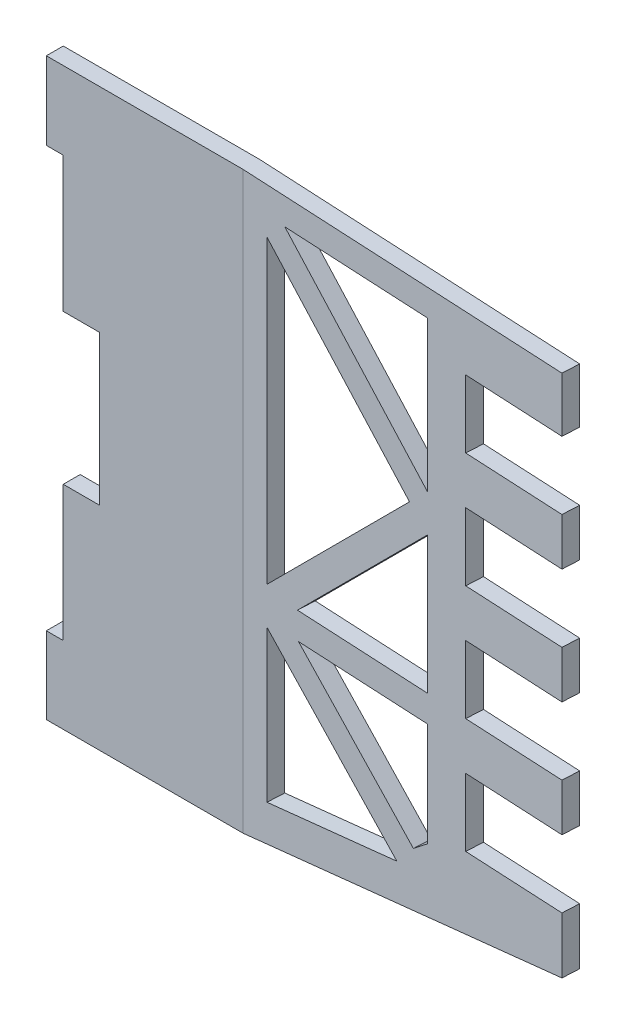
SolidWorks part; units mm, degrees
ref_plane "Front Plane" through (0, 0, 0) normal (0, 0, 1) x (1, 0, 0)
ref_plane "Top Plane" through (0, 0, 0) normal (0, 1, 0) x (1, 0, 0)
ref_plane "Right Plane" through (0, 0, 0) normal (1, 0, 0) x (0, 0, -1)
sketch "Sketch1" plane through (0, 0, 0) normal (0, 1, 0) x (1, 0, 0)
  line L0 (36.83, 0) -> (600, 0) construction
  line L1 (0, 0) -> (36.83, 0)
  line L2 (0, 0) -> (0, 5)
  line L3 (0, 5) -> (36.83, 5)
  line L4 (36.83, 0) -> (36.83, 5)
  line L5 (600, 0) -> (600, -28.58) construction
  line L6 (36.83, 0) -> (600, -28.58)
  line L7 (600, -28.58) -> (600, -23.58)
  line L8 (600, -23.58) -> (36.83, 5)
  line L9 (36.83, 2.5) -> (0, 2.5) construction
  point P5 (36.83, 2.5)
  dimension "D1" = 36.83
  dimension "D2" = 5
  dimension "D3" = 600
  dimension "D4" = 28.58
  dimension "D5" = 5
extrude "Boss-Extrude1" add sketch "Sketch1" along normal blind 106.172 contours L1 L4 L3 L2 | L7 L8 L4 L6
sketch "Sketch2" plane through (0.0946, 0, -1.8643) normal (-0.0507, 0, 0.9987) x (0.9987, 0, 0.0507)
  line L0 (590.6774, 84.16) -> (36.7827, 0)
  line L1 (590.6774, 84.16) -> (600.6774, 84.16)
  line L2 (600.6774, 106.172) -> (600.6774, 0) construction
  line L3 (36.7827, 0) -> (600.6774, 0) construction
  line L4 (600.6774, 84.16) -> (620.3149, 84.16)
  line L5 (620.3149, 84.16) -> (620.3149, 0)
  line L6 (620.3149, 0) -> (36.7827, 0)
  dimension "D1" = 8.64
  dimension "D2" = 10
  dimension "D3" = 84.16
extrude "Cut-Extrude1" cut sketch "Sketch2" against normal through all both and the other way through all contours L1 L0 M1 M2
sketch "Sketch3" plane through (0, 0, -5) normal (0, 0, -1) x (-1, 0, 0)
  line L0 (0, 106.172) -> (0, 91.6)
  line L1 (0, 106.172) -> (0, 0) construction
  line L2 (0, 91.6) -> (-3.1749, 91.6)
  line L3 (-3.1749, 91.6) -> (-3.1749, 66.2)
  line L4 (-3.1749, 66.2) -> (-10, 66.2)
  line L5 (0, 52.15) -> (-10, 52.15) construction
  line L6 (-10, 66.2) -> (-10, 38.1)
  line L7 (0, 106.172) -> (-36.83, 106.172) construction
  line L8 (-3.1749, 38.1) -> (-10, 38.1)
  line L9 (0, -1.872) -> (0, 12.7)
  line L10 (0, 12.7) -> (-3.1749, 12.7)
  line L11 (-3.1749, 12.7) -> (-3.1749, 38.1)
  dimension "D1" = 3.1749
  dimension "D2" = 10
  dimension "D3" = 14.572
  dimension "D4" = 28.1
sketch "Sketch6" plane through (0.3477, 0, -6.8514) normal (0.0507, 0, -0.9987) x (-0.9987, 0, -0.0507)
  line L0 (-168.5292, 101.172) -> (-168.5292, 37.672) construction
  line L1 (-600.424, 106.172) -> (-600.424, 69.422) construction
  line L2 (-600.424, 69.422) -> (-36.5292, 69.422) construction
  line L3 (-36.5292, 106.172) -> (-36.5292, 0) construction
  line L4 (-105.0292, 37.672) -> (-168.5292, 101.172) construction
  line L5 (-105.0292, 101.172) -> (-136.7792, 69.422) construction
  line L6 (-658.924, 89.16) -> (-653.7997, 89.16)
  line L7 (-105.0292, 5.7786) -> (-105.0292, 101.172)
  line L8 (-105.0292, 101.172) -> (-658.924, 101.172)
  line L9 (-658.924, 101.172) -> (-658.924, 89.16)
  line L10 (-136.7792, 69.422) -> (-168.5292, 37.672) construction
  line L11 (-232.0292, 101.172) -> (-232.0292, 37.672) construction
  line L12 (-168.5292, 37.672) -> (-232.0292, 101.172) construction
  line L13 (-168.5292, 101.172) -> (-200.2792, 69.422) construction
  line L14 (-722.424, 89.16) -> (-717.2997, 89.16)
  line L15 (-168.5292, 5.7786) -> (-168.5292, 101.172)
  line L16 (-168.5292, 101.172) -> (-722.424, 101.172)
  line L17 (-722.424, 101.172) -> (-722.424, 89.16)
  line L18 (-200.2792, 69.422) -> (-232.0292, 37.672) construction
  line L19 (-295.5292, 101.172) -> (-295.5292, 37.672) construction
  line L20 (-232.0292, 37.672) -> (-295.5292, 101.172) construction
  line L21 (-232.0292, 101.172) -> (-263.7792, 69.422) construction
  line L22 (-785.924, 89.16) -> (-780.7997, 89.16)
  line L23 (-232.0292, 5.7786) -> (-232.0292, 101.172)
  line L24 (-41.5292, 101.172) -> (-77.697, 101.172) construction
  line L25 (-41.5292, 37.672) -> (-595.424, 37.672)
  line L26 (-41.5292, 101.172) -> (-73.2792, 69.422) construction
  line L27 (-73.2792, 69.422) -> (-105.0292, 37.672) construction
  line L28 (-41.5292, 37.672) -> (-105.0292, 101.172) construction
  line L29 (-105.0292, 101.172) -> (-105.0292, 37.672) construction
  line L30 (-595.424, 89.16) -> (-590.2997, 89.16)
  line L32 (-41.5292, 5.7786) -> (-41.5292, 101.172)
  line L33 (-41.5292, 101.172) -> (-595.424, 101.172)
  line L34 (-595.424, 101.172) -> (-595.424, 89.16)
  line L37 (-41.5292, 5.7786) -> (-41.5292, 101.172)
  line L38 (-41.5292, 101.172) -> (-595.424, 101.172)
  line L39 (-595.424, 101.172) -> (-595.424, 89.16)
  line L40 (-232.0292, 101.172) -> (-785.924, 101.172)
  line L41 (-785.924, 101.172) -> (-785.924, 89.16)
  line L42 (-263.7792, 69.422) -> (-295.5292, 37.672) construction
  line L43 (-359.0292, 101.172) -> (-359.0292, 37.672) construction
  line L44 (-295.5292, 37.672) -> (-359.0292, 101.172) construction
  line L45 (-295.5292, 101.172) -> (-327.2792, 69.422) construction
  line L46 (-849.424, 89.16) -> (-844.2997, 89.16)
  line L47 (-295.5292, 5.7786) -> (-295.5292, 101.172)
  line L48 (-295.5292, 101.172) -> (-849.424, 101.172)
  line L49 (-849.424, 101.172) -> (-849.424, 89.16)
  line L50 (-327.2792, 69.422) -> (-359.0292, 37.672) construction
  line L51 (-422.5292, 101.172) -> (-422.5292, 37.672) construction
  line L52 (-359.0292, 37.672) -> (-422.5292, 101.172) construction
  line L53 (-359.0292, 101.172) -> (-390.7792, 69.422) construction
  line L54 (-912.924, 89.16) -> (-907.7997, 89.16)
  line L55 (-359.0292, 5.7786) -> (-359.0292, 101.172)
  line L56 (-359.0292, 101.172) -> (-912.924, 101.172)
  line L57 (-912.924, 101.172) -> (-912.924, 89.16)
  line L58 (-390.7792, 69.422) -> (-422.5292, 37.672) construction
  line L59 (-486.0292, 101.172) -> (-486.0292, 37.672) construction
  line L60 (-422.5292, 37.672) -> (-486.0292, 101.172) construction
  line L61 (-422.5292, 101.172) -> (-454.2792, 69.422) construction
  line L62 (-976.424, 89.16) -> (-971.2997, 89.16)
  line L63 (-422.5292, 5.7786) -> (-422.5292, 101.172)
  line L64 (-422.5292, 101.172) -> (-976.424, 101.172)
  line L65 (-976.424, 101.172) -> (-976.424, 89.16)
  line L66 (-454.2792, 69.422) -> (-486.0292, 37.672) construction
  line L67 (-549.5292, 101.172) -> (-549.5292, 37.672) construction
  line L68 (-486.0292, 37.672) -> (-549.5292, 101.172) construction
  line L69 (-486.0292, 101.172) -> (-517.7792, 69.422) construction
  line L70 (-1039.924, 89.16) -> (-1034.7997, 89.16)
  line L71 (-486.0292, 5.7786) -> (-486.0292, 101.172)
  line L72 (-486.0292, 101.172) -> (-1039.924, 101.172)
  line L73 (-1039.924, 101.172) -> (-1039.924, 89.16)
  line L74 (-517.7792, 69.422) -> (-549.5292, 37.672) construction
  line L75 (-484.2615, 39.4398) -> (-552.0292, 107.2075)
  line L76 (-552.0292, 107.2075) -> (-552.0292, 37.672)
  line L77 (-487.797, 102.9398) -> (-519.547, 71.1898)
  line L78 (-420.7615, 39.4398) -> (-484.2615, 102.9398)
  line L79 (-424.297, 102.9398) -> (-456.047, 71.1898)
  line L80 (-456.047, 71.1898) -> (-487.797, 39.4398)
  line L81 (-357.2615, 39.4398) -> (-420.7615, 102.9398)
  line L82 (-360.797, 102.9398) -> (-392.547, 71.1898)
  line L83 (-392.547, 71.1898) -> (-424.297, 39.4398)
  line L84 (-293.7615, 39.4398) -> (-357.2615, 102.9398)
  line L85 (-233.797, 102.9398) -> (-265.547, 71.1898)
  line L86 (-265.547, 71.1898) -> (-297.297, 39.4398)
  line L87 (-166.7615, 39.4398) -> (-230.2615, 102.9398)
  line L88 (-106.797, 102.9398) -> (-138.547, 71.1898)
  line L89 (-138.547, 71.1898) -> (-170.297, 39.4398)
  line L90 (-39.7615, 39.4398) -> (-103.2615, 102.9398)
  line L91 (-43.297, 102.9398) -> (-75.047, 71.1898)
  line L92 (-75.047, 71.1898) -> (-106.797, 39.4398)
  line L93 (-103.2615, 39.4398) -> (-166.7615, 102.9398)
  line L94 (-170.297, 102.9398) -> (-202.047, 71.1898)
  line L95 (-202.047, 71.1898) -> (-233.797, 39.4398)
  line L96 (-230.2615, 39.4398) -> (-293.7615, 102.9398)
  line L97 (-297.297, 102.9398) -> (-329.047, 71.1898)
  line L98 (-329.047, 71.1898) -> (-360.797, 39.4398)
  line L99 (-487.797, 35.9042) -> (-547.0292, 95.1365)
  line L100 (-547.0292, 95.1365) -> (-547.0292, 37.672)
  line L101 (-484.2615, 99.4042) -> (-516.0115, 67.6542)
  line L102 (-424.297, 35.9042) -> (-487.797, 99.4042)
  line L103 (-420.7615, 99.4042) -> (-452.5115, 67.6542)
  line L104 (-452.5115, 67.6542) -> (-484.2615, 35.9042)
  line L105 (-360.797, 35.9042) -> (-424.297, 99.4042)
  line L106 (-357.2615, 99.4042) -> (-389.0115, 67.6542)
  line L107 (-389.0115, 67.6542) -> (-420.7615, 35.9042)
  line L108 (-297.297, 35.9042) -> (-360.797, 99.4042)
  line L109 (-230.2615, 99.4042) -> (-262.0115, 67.6542)
  line L110 (-262.0115, 67.6542) -> (-293.7615, 35.9042)
  line L111 (-170.297, 35.9042) -> (-233.797, 99.4042)
  line L112 (-103.2615, 99.4042) -> (-135.0115, 67.6542)
  line L113 (-135.0115, 67.6542) -> (-166.7615, 35.9042)
  line L114 (-43.297, 35.9042) -> (-106.797, 99.4042)
  line L115 (-39.7615, 99.4042) -> (-71.5115, 67.6542)
  line L116 (-71.5115, 67.6542) -> (-103.2615, 35.9042)
  line L117 (-106.797, 35.9042) -> (-170.297, 99.4042)
  line L118 (-166.7615, 99.4042) -> (-198.5115, 67.6542)
  line L119 (-198.5115, 67.6542) -> (-230.2615, 35.9042)
  line L120 (-233.797, 35.9042) -> (-297.297, 99.4042)
  line L121 (-293.7615, 99.4042) -> (-325.5115, 67.6542)
  line L122 (-325.5115, 67.6542) -> (-357.2615, 35.9042)
  line L123 (-359.0292, 101.172) -> (-359.0292, 41.1594) construction
  line L124 (-293.0292, 5.7786) -> (-293.0292, 101.172)
  line L125 (-229.5292, 5.7786) -> (-229.5292, 101.172)
  line L126 (-166.0292, 5.7786) -> (-166.0292, 101.172)
  line L127 (-102.5292, 5.7786) -> (-102.5292, 101.172)
  line L128 (-356.5292, 5.7786) -> (-356.5292, 101.172)
  line L129 (-420.0292, 5.7786) -> (-420.0292, 101.172)
  line L130 (-483.5292, 5.7786) -> (-483.5292, 101.172)
  line L131 (-298.0292, 5.7786) -> (-298.0292, 101.172)
  line L132 (-234.5292, 5.7786) -> (-234.5292, 101.172)
  line L133 (-171.0292, 5.7786) -> (-171.0292, 101.172)
  line L134 (-107.5292, 5.7786) -> (-107.5292, 101.172)
  line L135 (-361.5292, 5.7786) -> (-361.5292, 101.172)
  line L136 (-425.0292, 5.7786) -> (-425.0292, 101.172)
  line L137 (-488.5292, 5.7786) -> (-488.5292, 101.172)
  line L138 (-168.5292, 37.672) -> (-168.5292, 25.0784) construction
  line L139 (-105.0292, 37.672) -> (-105.0292, 15.4269) construction
  line L140 (-103.2615, 39.4398) -> (-131.2391, 19.4093) construction
  line L141 (-131.2391, 19.4093) -> (-168.5292, 37.672) construction
  line L142 (-105.0292, 37.672) -> (-70.3619, 10.1595) construction
  line L143 (-70.3619, 10.1595) -> (-41.5292, 37.672) construction
  line L144 (-104.7168, 41.4725) -> (-131.4804, 22.3112)
  line L145 (-131.4804, 22.3112) -> (-167.4297, 39.9172)
  line L146 (-106.5833, 35.7137) -> (-70.2109, 6.848)
  line L147 (-70.2109, 6.848) -> (-35.2879, 40.172)
  line L148 (-35.2879, 40.172) -> (-595.424, 40.172)
  line L149 (-101.8062, 37.407) -> (-130.9978, 16.5074)
  line L150 (-130.9978, 16.5074) -> (-169.6288, 35.4268)
  line L151 (-103.4751, 39.6303) -> (-70.5129, 13.4709)
  line L152 (-70.5129, 13.4709) -> (-47.7706, 35.172)
  line L153 (-47.7706, 35.172) -> (-595.424, 35.172)
  line L160 (-595.424, 89.16) -> (-590.2997, 89.16)
  line L161 (-590.2997, 89.16) -> (-41.5292, 5.7786)
  line L162 (-590.2997, 89.16) -> (-41.5292, 5.7786)
  dimension "D1" = 63.5
  dimension "D3" = 63.5
  dimension "D4" = 8
  dimension "D5" = 2.5
  dimension "D2" = 5
  dimension "D6" = 2.5
  dimension "D7" = 2.5
  dimension "D8" = 2.5
  dimension "D9" = 2.5
  dimension "D10" = 2.5
extrude "Cut-Extrude5" cut sketch "Sketch6" against normal through all contours L148 L114 L116 | L37 L115 L90 | L152 L153 L151 | L146 L127 L162 | L147 L162 L37 | L134 L149 L162 | L144 L153 L145 | L162 L150 L126 | L133 L153 L162 | L148 L111 L119 | L87 L133 L118 | L126 L89 L117 | L93 L88 L38 | L93 L134 L112 | L148 L117 L113 | L127 L92 L114 | L91 L38 L90 | L94 L38 L87 | L125 L95 L111 | L96 L132 L109 | L96 L85 L40 | L124 L162 L86 L120 | L162 L131 L121 L84 | L97 L48 L84 | L128 L162 L98 L108 | L108 L122 L162 | L162 L135 L106 L81 | L82 L56 L81 | L129 L162 L83 L105 | L162 L136 L103 | L79 L64 L78 | L77 L72 L75 L162 | L99 L100 L162 | L162 L137 L101 | L130 L162 L102 | L148 L120 L110 L162
sketch "Sketch7" plane through (0.0946, 0, -1.8643) normal (-0.0507, 0, 0.9987) x (0.9987, 0, 0.0507)
  line L0 (600.6774, 106.172) -> (600.6774, 100.172)
  line L2 (600.6774, 106.172) -> (600.6774, 84.16) construction
  line L3 (600.6774, 100.172) -> (590.6774, 100.172)
  line L4 (590.6774, 100.172) -> (590.6774, 106.172)
  line L5 (36.7827, 106.172) -> (600.6774, 106.172) construction
  line L6 (590.6774, 106.172) -> (600.6774, 106.172)
  line L7 (600.6774, 95.166) -> (564.3609, 95.166) construction
  line L8 (590.6774, 90.16) -> (590.6774, 84.16)
  line L9 (600.6774, 90.16) -> (590.6774, 90.16)
  line L10 (600.6774, 84.16) -> (600.6774, 90.16)
  line L11 (590.6774, 84.16) -> (600.6774, 84.16)
  dimension "D1" = 10
  dimension "D2" = 6
extrude "Cut-Extrude6" cut sketch "Sketch7" against normal through all both and the other way through all
ref_plane "Plane1" through (98.9611, 40.172, 3.1531) normal (0.9987, 0, 0.0507) x (0.0507, 0, -0.9987)
sketch "Sketch11" plane through (0.3477, 0, -6.8514) normal (0.0507, 0, -0.9987) x (-0.9987, 0, -0.0507)
  line L0 (-73.2792, 72.9575) -> (-73.2792, 106.172)
  line L1 (-590.6774, 106.172) -> (-36.5292, 106.172) construction
  line L2 (-73.2792, 106.172) -> (-73.2792, 5.5454)
  line L3 (-590.6774, 84.16) -> (-36.7827, 0) construction
  line L4 (-102.5292, 43.7075) -> (-102.5292, 95.1365) construction
  line L5 (-102.5292, 43.7075) -> (-102.5292, 95.1365)
  line L6 (-102.5292, 95.1365) -> (-102.5292, 106.172)
  line L7 (-102.5292, 106.172) -> (-73.2792, 106.172)
  line L8 (-73.2792, 5.5454) -> (-102.5292, 9.9897)
  line L9 (-102.5292, 9.9897) -> (-102.5292, 43.7075)
extrude "Boss-Extrude2" add sketch "Sketch11" against normal up to surface (4.9936 mm away) contours L9 L8 L2 L0 L7 L6 L5
sketch "Sketch12" plane through (0.3477, 0, -6.8514) normal (0.0507, 0, -0.9987) x (-0.9987, 0, -0.0507)
  line L0 (-107.5292, 95.1365) -> (-73.2792, 95.1365) construction
  line L1 (-73.2792, 101.172) -> (-73.2792, 72.9575) construction
  line L2 (-90.4042, 95.1365) -> (-90.4042, 106.172) construction
  line L3 (-590.6774, 106.172) -> (-36.5292, 106.172) construction
  line L4 (-90.4042, 106.172) -> (-90.4042, 8.1474) construction
  line L5 (-590.6774, 84.16) -> (-36.7827, 0) construction
  line L6 (-351.4969, 47.8184) -> (-345.3367, 73.3687) construction
  line L7 (-99.9292, 74.3047) -> (-80.8792, 74.3047)
  line L8 (-90.4042, 57.1597) -> (-107.5292, 57.1597) construction
  line L10 (-107.5292, 43.7075) -> (-107.5292, 95.1365) construction
  line L11 (-99.9292, 61.6047) -> (-80.8792, 61.6047)
  line L12 (-80.8792, 61.6047) -> (-80.8792, 74.3047)
  line L14 (-99.9292, 74.3047) -> (-99.9292, 61.6047)
  line L15 (-99.9292, 83.1947) -> (-99.9292, 95.8947)
  line L17 (-80.8792, 95.8947) -> (-80.8792, 83.1947)
  line L18 (-80.8792, 83.1947) -> (-99.9292, 83.1947)
  line L20 (-99.9292, 95.8947) -> (-80.8792, 95.8947)
  line L21 (-80.8792, 66.1582) -> (-99.9292, 67.9547)
  line L22 (-80.8792, 89.3844) -> (-99.9292, 89.5447)
  line L23 (-99.9292, 40.0147) -> (-99.9292, 52.7147)
  line L24 (-99.9292, 52.7147) -> (-80.8792, 52.7147)
  line L25 (-80.8792, 52.7147) -> (-80.8792, 40.0147)
  line L26 (-99.9292, 40.0147) -> (-80.8792, 40.0147)
  line L27 (-99.9292, 31.1247) -> (-99.9292, 18.4247)
  line L28 (-80.8792, 31.1247) -> (-99.9292, 31.1247)
  line L29 (-80.8792, 18.4247) -> (-80.8792, 31.1247)
  line L30 (-99.9292, 18.4247) -> (-80.8792, 18.4247)
  line L31 (-99.9292, 106.172) -> (-99.9292, 9.5946)
  line L32 (-99.9292, 9.5946) -> (-80.8792, 6.7001)
  line L33 (-80.8792, 6.7001) -> (-80.8792, 106.172)
  line L34 (-80.8792, 106.172) -> (-99.9292, 106.172)
  line L43 (-600.424, 90.16) -> (-590.6774, 90.16)
  line L44 (-590.6774, 84.16) -> (-36.7827, 0)
  line L45 (-36.7827, 0) -> (-36.5292, 0)
  line L46 (-36.5292, 0) -> (-36.5292, 106.172)
  line L47 (-36.5292, 106.172) -> (-590.6774, 106.172)
  line L48 (-590.6774, 106.172) -> (-590.6774, 100.172)
  line L49 (-590.6774, 100.172) -> (-600.424, 100.172)
  line L50 (-600.424, 100.172) -> (-600.424, 90.16)
  line L53 (-590.6774, 84.16) -> (-36.7827, 0)
  line L54 (-36.7827, 0) -> (-36.5292, 0)
  line L55 (-36.5292, 0) -> (-36.5292, 106.172)
  line L56 (-36.5292, 106.172) -> (-590.6774, 106.172)
  line L57 (-590.6774, 106.172) -> (-590.6774, 100.172)
  line L58 (-590.6774, 100.172) -> (-600.424, 100.172)
  line L59 (-600.424, 100.172) -> (-600.424, 90.16)
  line L62 (-600.424, 90.16) -> (-590.6774, 90.16)
  line L63 (-590.6774, 90.16) -> (-590.6774, 84.16)
  line L64 (-590.6774, 90.16) -> (-590.6774, 84.16)
  point P25 (-90.4042, 67.0565)
  point P30 (-345.3367, 73.3687)
  point P33 (-90.4042, 89.4646)
  dimension "D1" = 12.7
  dimension "D2" = 4.445
  dimension "D3" = 19.05
  dimension "D4" = 19.05
  dimension "D5" = 8.89
  dimension "D6" = 12.7
  dimension "D7" = 48.0763
  dimension "D8" = 10.2773
  dimension "D9" = 7.6
  dimension "D10" = 19.05
  dimension "D11" = 19.05
  dimension "D12" = 0
extrude "Cut-Extrude7" cut sketch "Sketch12" against normal through all both and the other way through all contours L62 L64 L53 L31 L27 L23 L14 L15 L56 L57 L58 L59 | L22 L17 L20 L15 | L17 L22 L15 L18 | L21 L12 L7 L14 | L12 L21 L14 L11 | L23 L26 L25 L24 | L27 L30 L29 L28
ref_plane "Plane2" through (600, 90.16, 23.58) normal (0, -1, 0) x (-1, 0, 0)
sketch "Sketch13" plane through (600, 90.16, 23.58) normal (0, -1, 0) x (1, 0, 0)
  line L0 (-14.8253, 17.5592) -> (-10.9005, -22.081)
  line L1 (-10.9005, -22.081) -> (20.8901, -10.3067)
  line L2 (20.8901, -10.3067) -> (17.554, 36.9868)
  line L3 (17.554, 36.9868) -> (-14.8253, 17.5592)
extrude "Cut-Extrude8" cut sketch "Sketch13" along normal through all both and the other way through all
extrude "Cut-Extrude9" cut sketch "Sketch3" against normal through all both and the other way through all contours L5 L6 L8 L11 L10 M8 | L5 L2 L3 L4 L6 M8
sketch "Sketch14" plane through (0, 106.172, 0) normal (0, 1, 0) x (1, 0, 0)
  line L0 (36.83, 0) -> (99.8954, -3.2005) construction
  line L1 (0, 0) -> (36.83, 0) construction
  line L2 (36.83, 0) -> (99.8954, -3.2005)
  line L3 (0, 0) -> (36.83, 0)
  line L4 (0, 1.825) -> (36.8763, 1.825)
  line L5 (36.8763, 1.825) -> (99.9879, -1.3778)
  line L6 (0, 1.825) -> (0, 0)
  line L7 (99.9879, -1.3778) -> (99.8954, -3.2005)
  dimension "D1" = 1.825
extrude "Cut-Extrude10" cut sketch "Sketch14" against normal through all both and the other way through all
sketch "Sketch15" plane through (0, 0, -1.825) normal (0, 0, 1) x (1, 0, 0)
  line L0 (0, 0) -> (0, -1.745)
  line L1 (0, -1.745) -> (36.8763, -1.745)
  line L2 (36.8763, -1.745) -> (36.8763, 0)
  line L3 (36.8763, 0) -> (0, 0) construction
  line L4 (0, 0) -> (36.8763, 0)
  dimension "D1" = 1.745
extrude "Boss-Extrude3" add sketch "Sketch15" against normal up to surface (3.175 mm away)
sketch "Sketch17" plane through (0, 0, 0) normal (0, -1, 0) x (1, 0, 0)
  line L0 (36.8763, -5) -> (37.0831, -4.9872)
  line L1 (37.0831, -4.9872) -> (36.9225, -1.8227)
  line L2 (36.9225, -1.8227) -> (36.8763, -1.825)
  line L3 (36.8763, -1.825) -> (36.8763, -5)
extrude "Boss-Extrude7" add sketch "Sketch17" along normal up to surface (1.745 mm away)
sketch "Sketch18" plane through (0.1871, 0, -3.6869) normal (-0.0507, 0, 0.9987) x (0.9987, 0, 0.0507)
  line L0 (36.7827, 0) -> (99.9292, 9.5946)
  line L1 (99.9292, 9.5946) -> (99.9292, 7.8496)
  line L2 (99.9292, 7.8496) -> (36.7827, -1.745)
  line L3 (36.7827, 0) -> (36.7827, -1.745)
  line L25 (99.9292, 106.172) -> (36.7364, 106.172)
  line L26 (36.7364, 106.172) -> (36.7364, -1.745)
  line L27 (36.7364, -1.745) -> (36.7827, -1.745)
  line L28 (36.7827, -1.745) -> (36.7827, 0)
  line L29 (36.7827, 0) -> (99.9292, 9.5946)
  line L30 (99.9292, 9.5946) -> (99.9292, 18.4247)
  line L31 (99.9292, 18.4247) -> (80.8792, 18.4247)
  line L32 (80.8792, 18.4247) -> (80.8792, 31.1247)
  line L33 (80.8792, 31.1247) -> (99.9292, 31.1247)
  line L34 (99.9292, 31.1247) -> (99.9292, 40.0147)
  line L35 (99.9292, 40.0147) -> (80.8792, 40.0147)
  line L36 (80.8792, 40.0147) -> (80.8792, 52.7147)
  line L37 (80.8792, 52.7147) -> (99.9292, 52.7147)
  line L38 (99.9292, 52.7147) -> (99.9292, 61.6047)
  line L39 (99.9292, 61.6047) -> (80.8792, 61.6047)
  line L40 (80.8792, 61.6047) -> (80.8792, 74.3047)
  line L41 (80.8792, 74.3047) -> (99.9292, 74.3047)
  line L42 (99.9292, 74.3047) -> (99.9292, 83.1947)
  line L43 (99.9292, 83.1947) -> (80.8792, 83.1947)
  line L44 (80.8792, 83.1947) -> (80.8792, 95.8947)
  line L45 (80.8792, 95.8947) -> (99.9292, 95.8947)
  line L46 (99.9292, 95.8947) -> (99.9292, 106.172)
  line L47 (99.9292, 106.172) -> (36.7364, 106.172)
  line L51 (36.7827, 0) -> (99.9292, 9.5946)
  line L52 (99.9292, 9.5946) -> (99.9292, 18.4247)
  line L53 (99.9292, 18.4247) -> (80.8792, 18.4247)
  line L54 (80.8792, 18.4247) -> (80.8792, 31.1247)
  line L55 (80.8792, 31.1247) -> (99.9292, 31.1247)
  line L56 (99.9292, 31.1247) -> (99.9292, 40.0147)
  line L57 (99.9292, 40.0147) -> (80.8792, 40.0147)
  line L58 (80.8792, 40.0147) -> (80.8792, 52.7147)
  line L59 (80.8792, 52.7147) -> (99.9292, 52.7147)
  line L60 (99.9292, 52.7147) -> (99.9292, 61.6047)
  line L61 (99.9292, 61.6047) -> (80.8792, 61.6047)
  line L62 (80.8792, 61.6047) -> (80.8792, 74.3047)
  line L63 (80.8792, 74.3047) -> (99.9292, 74.3047)
  line L64 (99.9292, 74.3047) -> (99.9292, 83.1947)
  line L65 (99.9292, 83.1947) -> (80.8792, 83.1947)
  line L66 (80.8792, 83.1947) -> (80.8792, 95.8947)
  line L67 (80.8792, 95.8947) -> (99.9292, 95.8947)
  line L68 (99.9292, 95.8947) -> (99.9292, 106.172)
  dimension "D1" = 0
extrude "Boss-Extrude8" add sketch "Sketch18" against normal up to surface (3.1686 mm away) contours L0 L1 L2 L3
